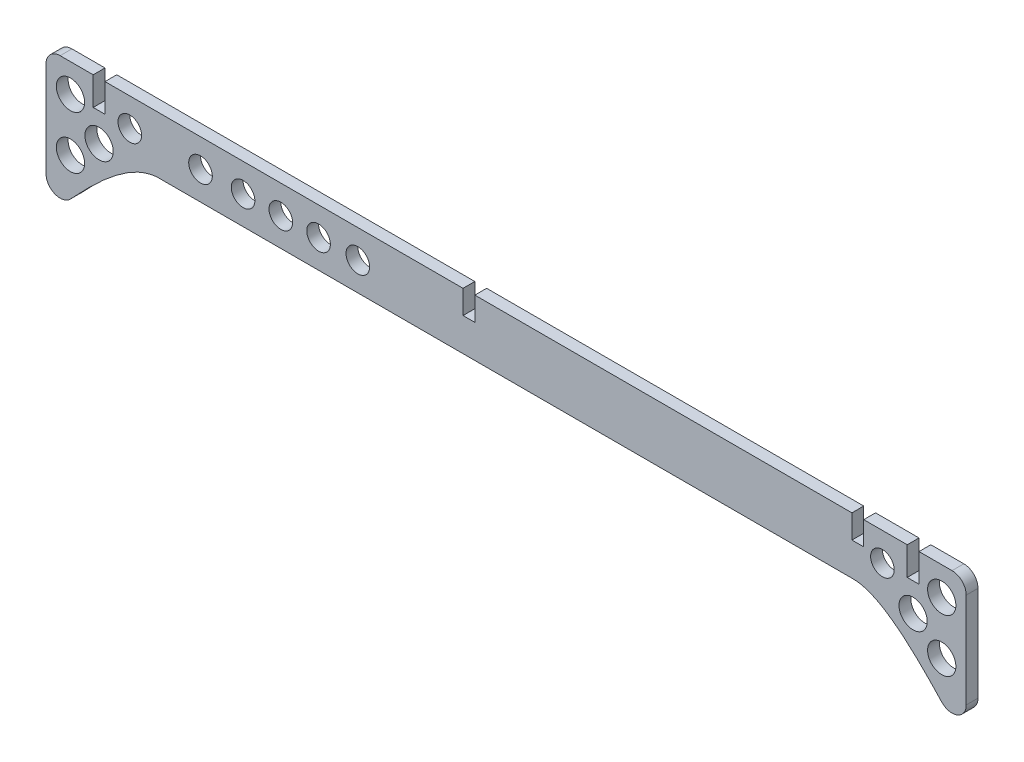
SolidWorks part; units mm, degrees
ref_plane "Front Plane" through (0, 0, 0) normal (0, 0, 1) x (1, 0, 0)
ref_plane "Top Plane" through (0, 0, 0) normal (0, 1, 0) x (1, 0, 0)
ref_plane "Right Plane" through (0, 0, 0) normal (1, 0, 0) x (0, 0, -1)
sketch "Sketch1" plane through (0, 0, 0) normal (0, 0, 1) x (1, 0, 0)
  line L0 (107.95, 0) -> (111.125, 0)
  line L1 (-123.825, 0) -> (-123.825, 3.81)
  line L2 (-123.825, 0) -> (-123.825, -21.7847)
  line L3 (96.2481, 7.62) -> (96.2481, 1.27)
  line L4 (93.4694, -7.62) -> (-93.4694, -7.62)
  line L5 (-111.125, 7.62) -> (-111.125, 0)
  line L6 (-107.95, 7.62) -> (-107.95, 0)
  line L7 (-111.125, 7.62) -> (-120.015, 7.62)
  line L8 (93.0731, 7.62) -> (93.0731, 1.27)
  line L9 (111.125, 7.62) -> (120.015, 7.62)
  line L10 (107.95, 7.62) -> (107.95, 0)
  line L11 (111.125, 7.62) -> (111.125, 0)
  line L12 (123.825, 0) -> (123.825, -21.7847)
  line L13 (123.825, 0) -> (123.825, 3.81)
  line L15 (-107.95, 0) -> (-111.125, 0)
  line L17 (-47.9313, 7.62) -> (-107.95, 7.62)
  line L18 (107.95, 7.62) -> (96.2481, 7.62)
  line L19 (93.0731, 1.27) -> (96.2481, 1.27)
  line L20 (93.0731, 7.62) -> (-8.4149, 7.62)
  line L21 (42.3291, 11.287) -> (42.3291, -16.8771) construction
  line L22 (-8.4149, 1.27) -> (-11.5899, 1.27)
  line L23 (-8.4149, 7.62) -> (-8.4149, 1.27)
  line L24 (-11.5899, 7.62) -> (-11.5899, 1.27)
  line L25 (-11.5899, 7.62) -> (-47.9313, 7.62)
  arc A0 (-123.825, -21.7847) -> (-117.24, -24.3953) centre (-120.015, -21.7847) ccw
  arc A1 (-123.825, 3.81) -> (-120.015, 7.62) centre (-120.015, 3.81) cw
  circle A2 centre (-117.24, 0) radius 3.81
  circle A3 centre (-101.2713, 0) radius 3.175
  circle A4 centre (-82.2416, 0) radius 3.175
  circle A6 centre (-70.7913, 0) radius 3.175
  circle A7 centre (-60.6313, 0) radius 3.175
  circle A8 centre (-50.4713, 0) radius 3.175
  circle A11 centre (-39.9082, 0) radius 3.175
  circle A23 centre (101.2713, 0) radius 3.175
  circle A24 centre (117.24, 0) radius 3.81
  arc A25 (123.825, 3.81) -> (120.015, 7.62) centre (120.015, 3.81) ccw
  arc A26 (123.825, -21.7847) -> (117.24, -24.3953) centre (120.015, -21.7847) cw
  circle A27 centre (-109.5375, -7.62) radius 3.81
  circle A28 centre (-117.24, -14.2125) radius 3.81
  circle A29 centre (117.24, -14.2125) radius 3.81
  circle A30 centre (109.5375, -7.62) radius 3.81
  spline S0 degree 3 poles (-117.24, -24.3953) (-110.981, -17.7422) (-101.3765, -7.6603) (-93.4694, -7.62) knots 0.386367 0.386367 0.386367 0.386367 1 1 1 1
  spline S1 degree 3 poles (117.24, -24.3953) (110.981, -17.7422) (101.3765, -7.6603) (93.4694, -7.62) knots 0.386367 0.386367 0.386367 0.386367 1 1 1 1
  point P14 (-123.825, 7.62)
  point P71 (0, -7.62)
  point P76 (123.825, 7.62)
  point P99 (-57.3044, 7.62)
  dimension "D1" = 3.81
  dimension "D2" = 3.81
  dimension "D3" = 3.175
  dimension "D5" = 12.7
  dimension "D6" = 3.175
extrude "Boss-Extrude1" add sketch "Sketch1" along normal blind 3.175
